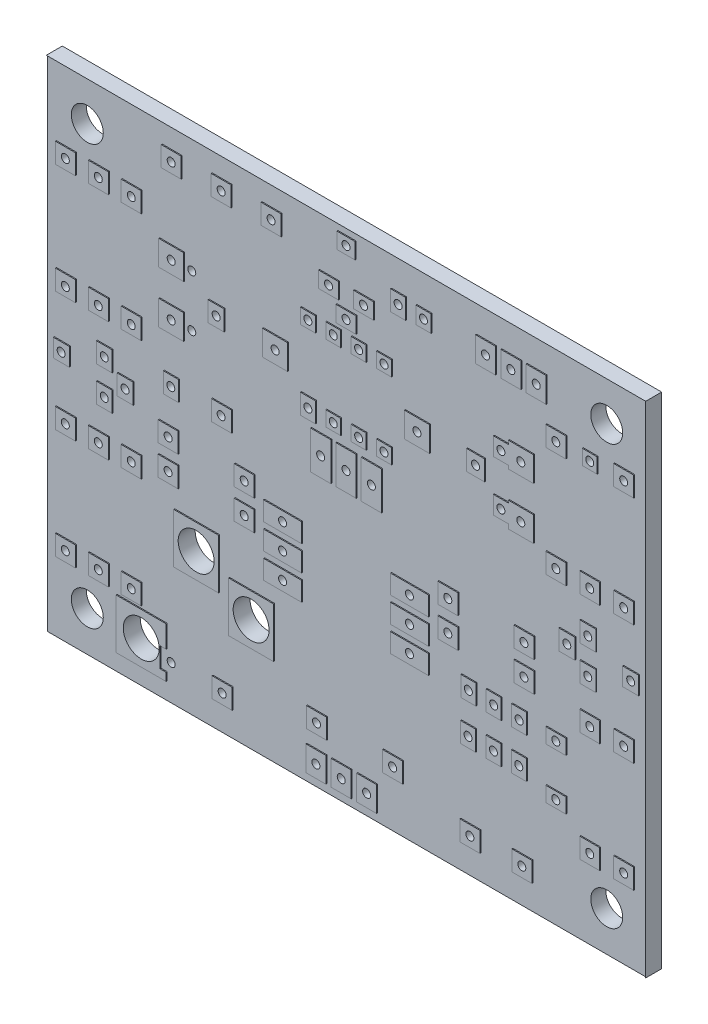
SolidWorks part; units mm, degrees
ref_plane "Plan de face" through (0, 0, 0) normal (0, 0, 1) x (1, 0, 0)
ref_plane "Plan de dessus" through (0, 0, 0) normal (0, 1, 0) x (1, 0, 0)
ref_plane "Plan de droite" through (0, 0, 0) normal (1, 0, 0) x (0, 0, -1)
sketch "Esquisse1" plane through (0, 0, 0) normal (0, 0, 1) x (1, 0, 0)
  line L1 (0, 0) -> (60, 0)
  line L2 (0, 0) -> (0, 50)
  line L3 (0, 50) -> (60, 50)
  line L4 (60, 0) -> (60, 50)
  dimension "D1" = 60
  dimension "D2" = 50
extrude "Extrusion1" add sketch "Esquisse1" along normal blind 1.7
sketch "Esquisse2" plane through (0, 0, 1.7) normal (0, 0, 1) x (1, 0, 0)
  line L408 (6.999, 1.702) -> (6.999, 6.702)
  line L409 (46.2499, 39.7499) -> (48.7499, 39.7499)
  line L410 (44.7569, 39.3829) -> (46.2569, 39.3829)
  line L411 (42.0669, 36.9429) -> (43.8669, 36.9429)
  line L412 (18.5, 45.9999) -> (16.5, 45.9999)
  line L413 (23.5, 45.9999) -> (21.5, 45.9999)
  line L414 (18.54, 26.4999) -> (16.54, 26.4999)
  line L415 (26.4439, 30.9049) -> (28.4759, 30.9049)
  line L416 (34.4449, 17.8875) -> (34.4449, 19.7925)
  line L417 (46.5451, 11.0587) -> (46.5451, 13.0587)
  line L418 (45.5051, 11.0587) -> (44.0051, 11.0587)
  line L419 (13.19, 24) -> (13.19, 22)
  line L420 (8.699, 24.001) -> (7.099, 24.001)
  line L421 (4.999, 24.251) -> (6.599, 24.251)
  line L422 (33.053, 39.3746) -> (33.053, 40.8746)
  line L423 (34.4661, 46.9861) -> (35.9661, 46.9861)
  line L424 (2.9, 18) -> (0.9, 18)
  line L425 (56.7999, 29.9999) -> (56.7999, 31.9999)
  line L426 (4.2, 9) -> (6.2, 9)
  line L427 (7.5, 42.9999) -> (9.5, 42.9999)
  line L428 (53.6499, 42.7499) -> (55.1499, 42.7499)
  line L429 (30.5219, 3.293) -> (30.5219, 0.793)
  line L430 (13.71, 32.4599) -> (13.71, 34.2599)
  line L431 (0, 49.9999) -> (59.9999, 49.9999)
  line L432 (13.75, 37.2499) -> (11.25, 37.2499)
  line L433 (13.75, 32.0499) -> (11.25, 32.0499)
  line L434 (43.8669, 36.9429) -> (43.8669, 34.9429)
  line L435 (13.4, 4.5) -> (13.4, 2.5)
  line L436 (11.5, 47.9999) -> (13.5, 47.9999)
  line L437 (51.9999, 15.29) -> (49.9999, 15.29)
  line L438 (33.5559, 30.9049) -> (33.5559, 27.0949)
  line L439 (38.2549, 17.8875) -> (34.4449, 17.8875)
  line L440 (41.4651, 11.0587) -> (41.4651, 13.0587)
  line L441 (41.4959, 17.068) -> (42.9959, 17.068)
  line L442 (42.9959, 15.068) -> (41.4959, 15.068)
  line L443 (45.5359, 15.068) -> (44.0359, 15.068)
  line L444 (33.6648, 6.6359) -> (35.6648, 6.6359)
  line L445 (41.1899, 22) -> (39.1899, 22)
  line L446 (27.2509, 45.0009) -> (29.2509, 45.0009)
  line L447 (29.2509, 43.4009) -> (27.2509, 43.4009)
  line L448 (32.7509, 43.4009) -> (30.7509, 43.4009)
  line L449 (30.7509, 43.4009) -> (30.7509, 45.0009)
  line L450 (34.5531, 33.2549) -> (34.5531, 31.7549)
  line L451 (38.5061, 46.8361) -> (38.5061, 45.1361)
  line L452 (38.5061, 45.1361) -> (37.0061, 45.1361)
  line L453 (2.9, 9) -> (2.9, 7)
  line L454 (6.2, 18) -> (4.2, 18)
  line L455 (51.9999, 31.9999) -> (51.9999, 29.9999)
  line L456 (58.7999, 20) -> (58.7999, 18)
  line L457 (9.5, 9) -> (9.5, 7)
  line L458 (9.5, 7) -> (7.5, 7)
  line L459 (9.5, 18) -> (7.5, 18)
  line L460 (48.0399, 47.2499) -> (50.0399, 47.2499)
  line L461 (48.0399, 44.7499) -> (48.0399, 47.2499)
  line L462 (12.7492, 12.0017) -> (12.7492, 17.0017)
  line L463 (22.749, 13.802) -> (22.749, 8.802)
  line L464 (11.999, 1.702) -> (6.999, 1.702)
  line L465 (48.7499, 34.5499) -> (48.7499, 32.0499)
  line L466 (48.7499, 37.2499) -> (46.2499, 37.2499)
  line L467 (13.5, 47.9999) -> (13.5, 45.9999)
  line L468 (28.9839, 27.0949) -> (28.9839, 30.9049)
  line L469 (42.9959, 17.068) -> (42.9959, 15.068)
  line L470 (20.81, 22) -> (18.81, 22)
  line L471 (59.3009, 25.8989) -> (59.3009, 24.099)
  line L472 (55.0009, 27.7489) -> (55.0009, 25.7489)
  line L473 (53.4009, 25.7489) -> (53.4009, 27.7489)
  line L474 (29.4731, 33.2549) -> (29.4731, 31.7549)
  line L475 (27.9731, 31.7549) -> (27.9731, 33.2549)
  line L476 (32.013, 33.2546) -> (32.013, 31.7546)
  line L477 (27.973, 40.8746) -> (29.473, 40.8746)
  line L478 (2.9, 31.9999) -> (2.9, 29.9999)
  line L479 (4.2, 31.9999) -> (6.2, 31.9999)
  line L480 (51.9999, 29.9999) -> (49.9999, 29.9999)
  line L481 (9.5, 29.9999) -> (7.5, 29.9999)
  line L482 (53.3999, 31.9999) -> (55.3999, 31.9999)
  line L483 (45.4999, 47.2499) -> (47.4999, 47.2499)
  line L484 (15.21, 39.3399) -> (15.21, 37.5399)
  line L485 (11.25, 34.5499) -> (13.75, 34.5499)
  line L486 (21.65, 34.6499) -> (21.65, 37.1499)
  line L487 (48.7499, 32.0499) -> (46.2499, 32.0499)
  line L488 (46.2499, 37.2499) -> (46.2499, 39.7499)
  line L489 (42.0669, 34.9429) -> (42.0669, 36.9429)
  line L490 (41.3999, 2.5) -> (41.3999, 4.5)
  line L491 (34.4449, 22.3325) -> (38.2549, 22.3325)
  line L492 (34.4449, 19.7925) -> (38.2549, 19.7925)
  line L493 (45.5051, 13.0587) -> (45.5051, 11.0587)
  line L494 (44.0359, 17.068) -> (45.5359, 17.068)
  line L495 (46.8099, 24) -> (48.8099, 24)
  line L496 (46.8099, 22) -> (46.8099, 24)
  line L497 (46.8099, 21) -> (48.8099, 21)
  line L498 (29.0009, 41.3009) -> (29.0009, 42.9009)
  line L499 (0.699, 24.101) -> (0.699, 25.9009)
  line L500 (33.0531, 33.2549) -> (34.5531, 33.2549)
  line L501 (35.9661, 46.9861) -> (35.9661, 44.9861)
  line L502 (7.5, 29.9999) -> (7.5, 31.9999)
  line L503 (53.3999, 18) -> (53.3999, 20)
  line L504 (31.0619, 3.293) -> (33.0619, 3.293)
  line L505 (16.2, 36.8999) -> (17.8, 36.8999)
  line L506 (17.2492, 12.0017) -> (12.7492, 12.0017)
  line L507 (35.8499, 37.1499) -> (38.3499, 37.1499)
  line L508 (16.6, 2.5) -> (16.6, 4.5)
  line L509 (13.4, 2.5) -> (11.4, 2.5)
  line L510 (49.9999, 11.71) -> (51.9999, 11.71)
  line L511 (49.9999, 10.21) -> (49.9999, 11.71)
  line L512 (38.2549, 22.3325) -> (38.2549, 20.4275)
  line L513 (34.4449, 15.3475) -> (34.4449, 17.2525)
  line L514 (25.5549, 17.8875) -> (21.745, 17.8875)
  line L515 (41.4651, 13.0587) -> (42.9651, 13.0587)
  line L516 (26.0448, 6.6359) -> (28.0448, 6.6359)
  line L517 (11.19, 22) -> (11.19, 24)
  line L518 (20.81, 21) -> (20.81, 19)
  line L519 (18.81, 19) -> (18.81, 21)
  line L520 (39.1899, 21) -> (41.1899, 21)
  line L521 (41.1899, 21) -> (41.1899, 19)
  line L522 (30.7509, 45.0009) -> (32.7509, 45.0009)
  line L523 (4.999, 22.251) -> (4.999, 24.251)
  line L524 (26.9331, 31.5049) -> (25.4331, 31.5049)
  line L525 (30.5131, 40.8749) -> (32.0131, 40.8749)
  line L526 (37.0061, 45.1361) -> (37.0061, 46.8361)
  line L527 (0.9, 31.9999) -> (2.9, 31.9999)
  line L528 (0.9, 40.9999) -> (0.9, 42.9999)
  line L529 (58.7999, 31.9999) -> (58.7999, 29.9999)
  line L530 (4.2, 20) -> (6.2, 20)
  line L531 (9.5, 40.9999) -> (7.5, 40.9999)
  line L532 (42.9599, 47.2499) -> (44.9599, 47.2499)
  line L533 (44.9599, 44.7499) -> (42.9599, 44.7499)
  line L534 (33.0619, 3.293) -> (33.0619, 0.793)
  line L535 (30.5219, 0.793) -> (28.5219, 0.793)
  line L536 (13.75, 34.5499) -> (13.75, 32.0499)
  line L537 (44.7569, 32.5029) -> (44.7569, 34.3029)
  line L538 (48.5999, 4.5) -> (48.5999, 2.5)
  line L539 (16.6, 4.5) -> (18.6, 4.5)
  line L540 (18.6, 4.5) -> (18.6, 2.5)
  line L541 (16.54, 28.4999) -> (18.54, 28.4999)
  line L542 (21.745, 22.3325) -> (25.5549, 22.3325)
  line L543 (21.745, 19.7925) -> (25.5549, 19.7925)
  line L544 (21.745, 17.2525) -> (25.5549, 17.2525)
  line L545 (25.5549, 17.2525) -> (25.5549, 15.3475)
  line L546 (41.1899, 19) -> (39.1899, 19)
  line L547 (7.099, 26.0009) -> (8.699, 26.0009)
  line L548 (59.3009, 24.099) -> (57.7009, 24.099)
  line L549 (29.473, 40.8746) -> (29.473, 39.3746)
  line L550 (25.433, 40.8746) -> (26.933, 40.8746)
  line L551 (37.0061, 46.8361) -> (38.5061, 46.8361)
  line L552 (0.9, 18) -> (0.9, 20)
  line L553 (4.2, 42.9999) -> (6.2, 42.9999)
  line L554 (6.2, 42.9999) -> (6.2, 40.9999)
  line L555 (6.2, 7) -> (4.2, 7)
  line L556 (56.7999, 18) -> (56.7999, 20)
  line L557 (9.5, 20) -> (9.5, 18)
  line L558 (55.1499, 41.2499) -> (53.6499, 41.2499)
  line L559 (47.4999, 47.2499) -> (47.4999, 44.7499)
  line L560 (27.9819, 3.293) -> (27.9819, 0.793)
  line L561 (15.21, 37.5399) -> (13.71, 37.5399)
  line L562 (12.7492, 17.0017) -> (17.2492, 17.0017)
  line L563 (22.749, 8.802) -> (18.249, 8.802)
  line L564 (13.75, 39.7499) -> (13.75, 37.2499)
  line L565 (11.71, 26.4999) -> (11.71, 28.4999)
  line L566 (31.5239, 30.9049) -> (33.5559, 30.9049)
  line L567 (44.0051, 13.0587) -> (45.5051, 13.0587)
  line L568 (11.19, 19) -> (11.19, 21)
  line L569 (6.599, 24.251) -> (6.599, 22.251)
  line L570 (52.9009, 23.999) -> (51.3009, 23.999)
  line L571 (25.4331, 33.5049) -> (26.9331, 33.5049)
  line L572 (25.4331, 31.5049) -> (25.4331, 33.5049)
  line L573 (33.053, 40.8746) -> (34.553, 40.8746)
  line L574 (0.9, 20) -> (2.9, 20)
  line L575 (4.2, 18) -> (4.2, 20)
  line L576 (58.7999, 18) -> (56.7999, 18)
  line L577 (9.5, 31.9999) -> (9.5, 29.9999)
  line L578 (7.5, 18) -> (7.5, 20)
  line L579 (55.3999, 7) -> (53.3999, 7)
  line L580 (53.3999, 7) -> (53.3999, 9)
  line L581 (13.71, 39.3399) -> (15.21, 39.3399)
  line L582 (21.65, 37.1499) -> (24.15, 37.1499)
  line L583 (46.2499, 32.0499) -> (46.2499, 34.5499)
  line L584 (38.3499, 37.1499) -> (38.3499, 34.6499)
  line L585 (44.7569, 37.5829) -> (44.7569, 39.3829)
  line L586 (43.3999, 2.5) -> (41.3999, 2.5)
  line L587 (49.9999, 16.79) -> (51.9999, 16.79)
  line L588 (13.21, 28.4999) -> (13.21, 26.4999)
  line L589 (28.4759, 30.9049) -> (28.4759, 27.0949)
  line L590 (31.0159, 30.9049) -> (31.0159, 27.0949)
  line L591 (48.0451, 13.0587) -> (48.0451, 11.0587)
  line L592 (46.5759, 17.068) -> (48.0759, 17.068)
  line L593 (48.8099, 22) -> (46.8099, 22)
  line L594 (11.19, 21) -> (13.19, 21)
  line L595 (48.8099, 21) -> (48.8099, 19)
  line L596 (31.0009, 41.3009) -> (29.0009, 41.3009)
  line L597 (29.2509, 45.0009) -> (29.2509, 43.4009)
  line L598 (27.9731, 33.2549) -> (29.4731, 33.2549)
  line L599 (29.4731, 31.7549) -> (27.9731, 31.7549)
  line L600 (34.553, 39.3746) -> (33.053, 39.3746)
  line L601 (25.433, 39.3746) -> (25.433, 40.8746)
  line L602 (4.2, 7) -> (4.2, 9)
  line L603 (49.9999, 42.9999) -> (51.9999, 42.9999)
  line L604 (7.5, 31.9999) -> (9.5, 31.9999)
  line L605 (53.3999, 9) -> (55.3999, 9)
  line L606 (50.0399, 44.7499) -> (48.0399, 44.7499)
  line L607 (25.9819, 3.293) -> (27.9819, 3.293)
  line L608 (17.8, 34.8999) -> (16.2, 34.8999)
  line L609 (11.25, 37.2499) -> (11.25, 39.7499)
  line L610 (46.5999, 4.5) -> (48.5999, 4.5)
  line L611 (11.4, 2.5) -> (11.4, 4.5)
  line L612 (51.9999, 16.79) -> (51.9999, 15.29)
  line L613 (16.54, 26.4999) -> (16.54, 28.4999)
  line L614 (28.9839, 30.9049) -> (31.0159, 30.9049)
  line L615 (31.5239, 27.0949) -> (31.5239, 30.9049)
  line L616 (34.4449, 20.4275) -> (34.4449, 22.3325)
  line L617 (25.5549, 22.3325) -> (25.5549, 20.4275)
  line L618 (35.6648, 6.6359) -> (35.6648, 4.6359)
  line L619 (48.8099, 24) -> (48.8099, 22)
  line L620 (18.81, 24) -> (20.81, 24)
  line L621 (18.81, 22) -> (18.81, 24)
  line L622 (48.8099, 19) -> (46.8099, 19)
  line L623 (57.7009, 24.099) -> (57.7009, 25.8989)
  line L624 (26.933, 40.8746) -> (26.933, 39.3746)
  line L625 (56.7999, 31.9999) -> (58.7999, 31.9999)
  line L626 (6.2, 40.9999) -> (4.2, 40.9999)
  line L627 (51.9999, 42.9999) -> (51.9999, 40.9999)
  line L628 (42.9599, 44.7499) -> (42.9599, 47.2499)
  line L629 (59.9999, 0) -> (0, 0)
  line L630 (24.15, 34.6499) -> (21.65, 34.6499)
  line L631 (48.7499, 39.7499) -> (48.7499, 37.2499)
  line L632 (51.9999, 11.71) -> (51.9999, 10.21)
  line L633 (31.0159, 27.0949) -> (28.9839, 27.0949)
  line L634 (21.745, 15.3475) -> (21.745, 17.2525)
  line L635 (46.5451, 13.0587) -> (48.0451, 13.0587)
  line L636 (48.0451, 11.0587) -> (46.5451, 11.0587)
  line L637 (48.0759, 17.068) -> (48.0759, 15.068)
  line L638 (28.0448, 4.6359) -> (26.0448, 4.6359)
  line L639 (39.1899, 22) -> (39.1899, 24)
  line L640 (30.9009, 47.7009) -> (29.1009, 47.7009)
  line L641 (29.0009, 42.9009) -> (31.0009, 42.9009)
  line L642 (51.3009, 23.999) -> (51.3009, 25.9989)
  line L643 (29.473, 39.3746) -> (27.973, 39.3746)
  line L644 (0.9, 7) -> (0.9, 9)
  line L645 (4.2, 40.9999) -> (4.2, 42.9999)
  line L646 (49.9999, 29.9999) -> (49.9999, 31.9999)
  line L647 (55.1499, 42.7499) -> (55.1499, 41.2499)
  line L648 (55.3999, 20) -> (55.3999, 18)
  line L649 (44.9599, 47.2499) -> (44.9599, 44.7499)
  line L650 (17.2492, 17.0017) -> (17.2492, 12.0017)
  line L651 (24.15, 37.1499) -> (24.15, 34.6499)
  line L652 (35.8499, 34.6499) -> (35.8499, 37.1499)
  line L653 (43.8669, 34.9429) -> (42.0669, 34.9429)
  line L654 (46.5999, 2.5) -> (46.5999, 4.5)
  line L655 (41.3999, 4.5) -> (43.3999, 4.5)
  line L656 (18.6, 2.5) -> (16.6, 2.5)
  line L657 (11.4, 4.5) -> (13.4, 4.5)
  line L658 (51.9999, 10.21) -> (49.9999, 10.21)
  line L659 (18.54, 28.4999) -> (18.54, 26.4999)
  line L660 (11.71, 28.4999) -> (13.21, 28.4999)
  line L661 (28.4759, 27.0949) -> (26.4439, 27.0949)
  line L662 (33.5559, 27.0949) -> (31.5239, 27.0949)
  line L663 (35.6648, 4.6359) -> (33.6648, 4.6359)
  line L664 (39.1899, 19) -> (39.1899, 21)
  line L665 (46.8099, 19) -> (46.8099, 21)
  line L666 (30.9009, 49.3009) -> (30.9009, 47.7009)
  line L667 (29.1009, 47.7009) -> (29.1009, 49.3009)
  line L668 (27.2509, 43.4009) -> (27.2509, 45.0009)
  line L669 (6.599, 25.7509) -> (4.999, 25.7509)
  line L670 (55.0009, 25.7489) -> (53.4009, 25.7489)
  line L671 (55.0009, 24.249) -> (55.0009, 22.249)
  line L672 (53.4009, 22.249) -> (53.4009, 24.249)
  line L673 (32.013, 31.7546) -> (30.513, 31.7546)
  line L674 (35.9661, 44.9861) -> (34.4661, 44.9861)
  line L675 (2.9, 7) -> (0.9, 7)
  line L676 (58.7999, 40.9999) -> (56.7999, 40.9999)
  line L677 (56.7999, 40.9999) -> (56.7999, 42.9999)
  line L678 (6.2, 29.9999) -> (4.2, 29.9999)
  line L679 (6.2, 9) -> (6.2, 7)
  line L680 (7.5, 20) -> (9.5, 20)
  line L681 (45.4999, 44.7499) -> (45.4999, 47.2499)
  line L682 (28.5219, 3.293) -> (30.5219, 3.293)
  line L683 (25.9819, 0.793) -> (25.9819, 3.293)
  line L684 (17.8, 36.8999) -> (17.8, 34.8999)
  line L685 (13.71, 37.5399) -> (13.71, 39.3399)
  line L686 (13.71, 34.2599) -> (15.21, 34.2599)
  line L687 (11.25, 39.7499) -> (13.75, 39.7499)
  line L688 (44.7569, 34.3029) -> (46.2569, 34.3029)
  line L689 (48.5999, 2.5) -> (46.5999, 2.5)
  line L690 (13.5, 45.9999) -> (11.5, 45.9999)
  line L691 (13.21, 26.4999) -> (11.71, 26.4999)
  line L692 (34.4449, 17.2525) -> (38.2549, 17.2525)
  line L693 (21.745, 20.4275) -> (21.745, 22.3325)
  line L694 (42.9651, 11.0587) -> (41.4651, 11.0587)
  line L695 (45.5359, 17.068) -> (45.5359, 15.068)
  line L696 (28.0448, 6.6359) -> (28.0448, 4.6359)
  line L697 (13.19, 21) -> (13.19, 19)
  line L698 (6.599, 27.7509) -> (6.599, 25.7509)
  line L699 (57.7009, 25.8989) -> (59.3009, 25.8989)
  line L700 (26.9331, 33.5049) -> (26.9331, 31.5049)
  line L701 (30.513, 31.7546) -> (30.513, 33.2546)
  line L702 (2.9, 42.9999) -> (2.9, 40.9999)
  line L703 (58.7999, 42.9999) -> (58.7999, 40.9999)
  line L704 (6.2, 31.9999) -> (6.2, 29.9999)
  line L705 (49.9999, 40.9999) -> (49.9999, 42.9999)
  line L706 (56.7999, 9) -> (58.7999, 9)
  line L707 (9.5, 42.9999) -> (9.5, 40.9999)
  line L708 (53.3999, 29.9999) -> (53.3999, 31.9999)
  line L709 (53.3999, 20) -> (55.3999, 20)
  line L710 (0, 0) -> (0, 49.9999)
  line L711 (59.9999, 49.9999) -> (59.9999, 0)
  line L712 (46.2569, 37.5829) -> (44.7569, 37.5829)
  line L713 (46.2569, 32.5029) -> (44.7569, 32.5029)
  line L714 (18.5, 47.9999) -> (18.5, 45.9999)
  line L715 (21.5, 47.9999) -> (23.5, 47.9999)
  line L716 (21.745, 17.8875) -> (21.745, 19.7925)
  line L717 (25.5549, 15.3475) -> (21.745, 15.3475)
  line L718 (44.0359, 15.068) -> (44.0359, 17.068)
  line L719 (41.1899, 24) -> (41.1899, 22)
  line L720 (13.19, 22) -> (11.19, 22)
  line L721 (0.699, 25.9009) -> (2.299, 25.9009)
  line L722 (2.299, 25.9009) -> (2.299, 24.101)
  line L723 (7.099, 24.001) -> (7.099, 26.0009)
  line L724 (4.999, 25.7509) -> (4.999, 27.7509)
  line L725 (55.0009, 22.249) -> (53.4009, 22.249)
  line L726 (33.0531, 31.7549) -> (33.0531, 33.2549)
  line L727 (49.9999, 31.9999) -> (51.9999, 31.9999)
  line L728 (7.5, 7) -> (7.5, 9)
  line L729 (6.999, 6.702) -> (11.999, 6.702)
  line L730 (46.2499, 34.5499) -> (48.7499, 34.5499)
  line L731 (38.2549, 19.7925) -> (38.2549, 17.8875)
  line L732 (25.5549, 20.4275) -> (21.745, 20.4275)
  line L733 (25.5549, 19.7925) -> (25.5549, 17.8875)
  line L734 (48.0759, 15.068) -> (46.5759, 15.068)
  line L735 (32.7509, 45.0009) -> (32.7509, 43.4009)
  line L736 (6.599, 22.251) -> (4.999, 22.251)
  line L737 (51.3009, 25.9989) -> (52.9009, 25.9989)
  line L738 (53.4009, 24.249) -> (55.0009, 24.249)
  line L739 (32.0131, 39.3749) -> (30.5131, 39.3749)
  line L740 (2.9, 29.9999) -> (0.9, 29.9999)
  line L741 (4.2, 29.9999) -> (4.2, 31.9999)
  line L742 (51.9999, 40.9999) -> (49.9999, 40.9999)
  line L743 (56.7999, 7) -> (56.7999, 9)
  line L744 (7.5, 9) -> (9.5, 9)
  line L745 (47.4999, 44.7499) -> (45.4999, 44.7499)
  line L746 (28.5219, 0.793) -> (28.5219, 3.293)
  line L747 (15.21, 34.2599) -> (15.21, 32.4599)
  line L748 (18.249, 8.802) -> (18.249, 13.802)
  line L749 (11.999, 6.702) -> (11.999, 1.702)
  line L750 (46.2569, 39.3829) -> (46.2569, 37.5829)
  line L751 (23.5, 47.9999) -> (23.5, 45.9999)
  line L752 (21.5, 45.9999) -> (21.5, 47.9999)
  line L753 (26.4439, 27.0949) -> (26.4439, 30.9049)
  line L754 (42.9651, 13.0587) -> (42.9651, 11.0587)
  line L755 (33.6648, 4.6359) -> (33.6648, 6.6359)
  line L756 (53.4009, 27.7489) -> (55.0009, 27.7489)
  line L757 (30.513, 33.2546) -> (32.013, 33.2546)
  line L758 (34.553, 40.8746) -> (34.553, 39.3746)
  line L759 (2.9, 20) -> (2.9, 18)
  line L760 (58.7999, 29.9999) -> (56.7999, 29.9999)
  line L761 (56.7999, 42.9999) -> (58.7999, 42.9999)
  line L762 (6.2, 20) -> (6.2, 18)
  line L763 (58.7999, 7) -> (56.7999, 7)
  line L764 (7.5, 40.9999) -> (7.5, 42.9999)
  line L765 (55.3999, 29.9999) -> (53.3999, 29.9999)
  line L766 (55.3999, 9) -> (55.3999, 7)
  line L767 (15.21, 32.4599) -> (13.71, 32.4599)
  line L768 (18.249, 13.802) -> (22.749, 13.802)
  line L769 (38.3499, 34.6499) -> (35.8499, 34.6499)
  line L770 (46.2569, 34.3029) -> (46.2569, 32.5029)
  line L771 (16.5, 47.9999) -> (18.5, 47.9999)
  line L772 (16.5, 45.9999) -> (16.5, 47.9999)
  line L773 (38.2549, 20.4275) -> (34.4449, 20.4275)
  line L774 (46.5759, 15.068) -> (46.5759, 17.068)
  line L775 (39.1899, 24) -> (41.1899, 24)
  line L776 (13.19, 19) -> (11.19, 19)
  line L777 (31.0009, 42.9009) -> (31.0009, 41.3009)
  line L778 (2.299, 24.101) -> (0.699, 24.101)
  line L779 (52.9009, 25.9989) -> (52.9009, 23.999)
  line L780 (34.5531, 31.7549) -> (33.0531, 31.7549)
  line L781 (27.973, 39.3746) -> (27.973, 40.8746)
  line L782 (34.4661, 44.9861) -> (34.4661, 46.9861)
  line L783 (0.9, 9) -> (2.9, 9)
  line L784 (56.7999, 20) -> (58.7999, 20)
  line L785 (55.3999, 31.9999) -> (55.3999, 29.9999)
  line L786 (53.6499, 41.2499) -> (53.6499, 42.7499)
  line L787 (16.2, 34.8999) -> (16.2, 36.8999)
  line L788 (11.25, 32.0499) -> (11.25, 34.5499)
  line L789 (43.3999, 4.5) -> (43.3999, 2.5)
  line L790 (11.5, 45.9999) -> (11.5, 47.9999)
  line L791 (49.9999, 15.29) -> (49.9999, 16.79)
  line L792 (38.2549, 17.2525) -> (38.2549, 15.3475)
  line L793 (38.2549, 15.3475) -> (34.4449, 15.3475)
  line L794 (44.0051, 11.0587) -> (44.0051, 13.0587)
  line L795 (41.4959, 15.068) -> (41.4959, 17.068)
  line L796 (26.0448, 4.6359) -> (26.0448, 6.6359)
  line L797 (20.81, 24) -> (20.81, 22)
  line L798 (11.19, 24) -> (13.19, 24)
  line L799 (18.81, 21) -> (20.81, 21)
  line L800 (20.81, 19) -> (18.81, 19)
  line L801 (29.1009, 49.3009) -> (30.9009, 49.3009)
  line L802 (8.699, 26.0009) -> (8.699, 24.001)
  line L803 (4.999, 27.7509) -> (6.599, 27.7509)
  line L804 (32.0131, 40.8749) -> (32.0131, 39.3749)
  line L805 (30.5131, 39.3749) -> (30.5131, 40.8749)
  line L806 (26.933, 39.3746) -> (25.433, 39.3746)
  line L807 (0.9, 29.9999) -> (0.9, 31.9999)
  line L808 (0.9, 42.9999) -> (2.9, 42.9999)
  line L809 (2.9, 40.9999) -> (0.9, 40.9999)
  line L810 (58.7999, 9) -> (58.7999, 7)
  line L811 (55.3999, 18) -> (53.3999, 18)
  line L812 (50.0399, 47.2499) -> (50.0399, 44.7499)
  line L813 (33.0619, 0.793) -> (31.0619, 0.793)
  line L814 (31.0619, 0.793) -> (31.0619, 3.293)
  line L815 (27.9819, 0.793) -> (25.9819, 0.793)
  point P1 (35.2161, 45.9999)
  point P2 (37.7561, 45.9999)
  point P3 (43.9599, 45.9999)
  point P4 (46.4999, 45.9999)
  point P5 (49.0399, 45.9999)
  point P6 (50.9999, 41.9999)
  point P7 (54.3999, 41.9999)
  point P8 (57.7999, 41.9999)
  point P9 (12.5, 46.9861)
  point P10 (17.5, 46.9861)
  point P11 (22.5, 46.9861)
  point P12 (30.0009, 48.5009)
  point P13 (28.2509, 44.2009)
  point P14 (31.7509, 44.2009)
  point P15 (47.4999, 38.4999)
  point P16 (45.5069, 38.4829)
  point P17 (42.9669, 35.9429)
  point P18 (47.4999, 33.2999)
  point P19 (45.5069, 33.4029)
  point P20 (50.9999, 30.9999)
  point P21 (54.3999, 30.9999)
  point P22 (57.7999, 30.9999)
  point P23 (54.2009, 26.7489)
  point P24 (58.5009, 24.999)
  point P25 (54.2009, 23.249)
  point P26 (54.3999, 19)
  point P27 (57.7999, 19)
  point P28 (50.9999, 16.04)
  point P29 (47.3259, 16.04)
  point P30 (44.7859, 16.068)
  point P31 (42.2459, 16.068)
  point P32 (42.2151, 12.0587)
  point P33 (44.7551, 12.0587)
  point P34 (47.2951, 12.0587)
  point P35 (50.9999, 10.96)
  point P36 (54.3999, 8)
  point P37 (57.7999, 8)
  point P38 (47.5999, 3.5)
  point P39 (42.3999, 3.5)
  point P40 (34.6648, 5.6359)
  point P41 (32.0619, 2.043)
  point P42 (29.5219, 2.043)
  point P43 (26.9819, 2.043)
  point P44 (27.0448, 5.6359)
  point P45 (20.499, 11.302)
  point P46 (17.6, 3.5)
  point P47 (12.4, 3.5)
  point P48 (9.499, 4.202)
  point P49 (8.5, 8)
  point P50 (5.2, 8)
  point P51 (1.9, 8)
  point P52 (1.9, 19)
  point P53 (5.2, 19)
  point P54 (8.5, 19)
  point P55 (12.19, 20)
  point P56 (30.0009, 42.1009)
  point P57 (26.183, 40.1246)
  point P58 (28.723, 40.1246)
  point P59 (31.2631, 40.1246)
  point P60 (33.803, 40.1246)
  point P61 (37.0999, 35.8999)
  point P62 (33.8031, 32.5029)
  point P63 (31.263, 32.5029)
  point P64 (28.7231, 32.5029)
  point P65 (26.1831, 32.5029)
  point P66 (22.9, 35.8999)
  point P67 (17, 35.8999)
  point P68 (14.46, 38.4829)
  point P69 (12.5, 38.4829)
  point P70 (8.5, 41.9999)
  point P71 (5.2, 41.9999)
  point P72 (1.9, 41.9999)
  point P73 (1.9, 30.9049)
  point P74 (5.2, 30.9049)
  point P75 (8.5, 30.9049)
  point P76 (5.799, 26.7489)
  point P77 (12.46, 27.4999)
  point P78 (17.5, 27.4999)
  point P79 (12.5, 33.2999)
  point P80 (14.46, 33.2999)
  point P81 (1.482, 24.999)
  point P82 (7.8779, 24.999)
  point P83 (5.799, 23.249)
  point P84 (12.19, 23)
  point P85 (19.81, 23)
  point P86 (19.81, 20)
  point P87 (23.65, 21.38)
  point P88 (23.65, 18.84)
  point P89 (23.65, 16.3)
  point P90 (14.9992, 14.5017)
  point P91 (36.3499, 16.3)
  point P92 (36.3499, 18.84)
  point P93 (36.3499, 21.38)
  point P94 (40.1899, 23)
  point P95 (40.1899, 20)
  point P96 (47.8099, 20)
  point P97 (47.8099, 23)
  point P98 (52.1009, 24.999)
  point P99 (27.4599, 28.9999)
  point P100 (29.9999, 28.9999)
  point P101 (32.5399, 28.9999)
extrude "Extrusion4" cut sketch "Esquisse2" against normal blind 0.1
sketch "Esquisse5" plane through (0, 0, 1.7) normal (0, 0, 1) x (1, 0, 0)
  circle A0 centre (12.5, 46.9861) radius 0.4
  circle A1 centre (17.5, 46.9861) radius 0.4
  circle A2 centre (22.5, 46.9861) radius 0.4
  circle A3 centre (30.0009, 48.5009) radius 0.4
  circle A4 centre (28.2509, 44.2009) radius 0.4
  circle A5 centre (31.7509, 44.2009) radius 0.4
  circle A6 centre (35.2161, 45.9999) radius 0.4
  circle A7 centre (37.7561, 45.9999) radius 0.4
  circle A8 centre (42.9669, 35.9429) radius 0.4
  circle A9 centre (45.5069, 38.4829) radius 0.4
  circle A10 centre (43.9599, 45.9999) radius 0.4
  circle A11 centre (46.4999, 45.9999) radius 0.4
  circle A12 centre (49.0399, 45.9999) radius 0.4
  circle A13 centre (50.9999, 41.9999) radius 0.4
  circle A14 centre (1.9, 41.9999) radius 0.4
  circle A15 centre (5.2, 41.9999) radius 0.4
  circle A16 centre (8.5, 41.9999) radius 0.4
  circle A17 centre (12.5, 38.4829) radius 0.4
  circle A18 centre (14.46, 38.4829) radius 0.4
  circle A19 centre (17, 35.8999) radius 0.4
  circle A20 centre (12.5, 33.2999) radius 0.4
  circle A21 centre (14.46, 33.2999) radius 0.4
  circle A22 centre (22.9, 35.8999) radius 0.4
  circle A23 centre (26.183, 40.1246) radius 0.4
  circle A24 centre (30.0009, 42.1009) radius 0.4
  circle A25 centre (28.723, 40.1246) radius 0.4
  circle A26 centre (31.2631, 40.1246) radius 0.4
  circle A27 centre (33.803, 40.1246) radius 0.4
  circle A28 centre (8.5, 30.9049) radius 0.4
  circle A29 centre (5.2, 30.9049) radius 0.4
  circle A30 centre (1.9, 30.9049) radius 0.4
  circle A31 centre (1.482, 24.999) radius 0.4
  circle A32 centre (5.799, 26.7489) radius 0.4
  circle A33 centre (7.8779, 24.999) radius 0.4
  circle A34 centre (5.799, 23.249) radius 0.4
  circle A35 centre (12.46, 27.4999) radius 0.4
  circle A36 centre (17.5, 27.4999) radius 0.4
  circle A37 centre (26.1831, 32.5029) radius 0.4
  circle A38 centre (28.7231, 32.5029) radius 0.4
  circle A39 centre (31.263, 32.5029) radius 0.4
  circle A40 centre (33.8031, 32.5029) radius 0.4
  circle A41 centre (37.0999, 35.8999) radius 0.4
  circle A42 centre (27.4599, 28.9999) radius 0.4
  circle A43 centre (29.9999, 28.9999) radius 0.4
  circle A44 centre (32.5399, 28.9999) radius 0.4
  circle A45 centre (45.5069, 33.4029) radius 0.4
  circle A46 centre (47.4999, 38.4999) radius 0.4
  circle A47 centre (54.3999, 41.9999) radius 0.4
  circle A48 centre (57.7999, 41.9999) radius 0.4
  circle A49 centre (47.4999, 33.2999) radius 0.4
  circle A50 centre (50.9999, 30.9999) radius 0.4
  circle A51 centre (54.3999, 30.9999) radius 0.4
  circle A52 centre (57.7999, 30.9999) radius 0.4
  circle A53 centre (54.2009, 26.7489) radius 0.4
  circle A54 centre (58.5009, 24.999) radius 0.4
  circle A55 centre (52.1009, 24.999) radius 0.4
  circle A56 centre (54.2009, 23.249) radius 0.4
  circle A57 centre (47.8099, 23) radius 0.4
  circle A58 centre (47.8099, 20) radius 0.4
  circle A59 centre (54.3999, 19) radius 0.4
  circle A60 centre (57.7999, 19) radius 0.4
  circle A61 centre (50.9999, 16.04) radius 0.4
  circle A62 centre (47.3259, 16.04) radius 0.4
  circle A63 centre (44.7859, 16.068) radius 0.4
  circle A64 centre (42.2459, 16.068) radius 0.4
  circle A65 centre (40.1899, 23) radius 0.4
  circle A66 centre (40.1899, 20) radius 0.4
  circle A67 centre (36.3499, 21.38) radius 0.4
  circle A68 centre (36.3499, 18.84) radius 0.4
  circle A69 centre (36.3499, 16.3) radius 0.4
  circle A70 centre (23.65, 21.38) radius 0.4
  circle A71 centre (23.65, 18.84) radius 0.4
  circle A72 centre (19.81, 23) radius 0.4
  circle A73 centre (19.81, 20) radius 0.4
  circle A74 centre (12.19, 23) radius 0.4
  circle A75 centre (14.9992, 14.5017) radius 0.4
  circle A76 centre (23.65, 16.3) radius 0.4
  circle A77 centre (12.19, 20) radius 0.4
  circle A78 centre (1.9, 19) radius 0.4
  circle A79 centre (5.2, 19) radius 0.4
  circle A80 centre (8.5, 19) radius 0.4
  circle A81 centre (20.499, 11.302) radius 0.4
  circle A82 centre (1.9, 8) radius 0.4
  circle A83 centre (5.2, 8) radius 0.4
  circle A84 centre (8.5, 8) radius 0.4
  circle A85 centre (9.499, 4.202) radius 0.4
  circle A86 centre (12.4, 3.5) radius 0.4
  circle A87 centre (17.6, 3.5) radius 0.4
  circle A88 centre (27.0448, 5.6359) radius 0.4
  circle A89 centre (26.9819, 2.043) radius 0.4
  circle A90 centre (29.5219, 2.043) radius 0.4
  circle A91 centre (32.0619, 2.043) radius 0.4
  circle A92 centre (34.6648, 5.6359) radius 0.4
  circle A93 centre (42.2151, 12.0587) radius 0.4
  circle A94 centre (44.7551, 12.0587) radius 0.4
  circle A95 centre (47.2951, 12.0587) radius 0.4
  circle A96 centre (50.9999, 10.96) radius 0.4
  circle A97 centre (42.3999, 3.5) radius 0.4
  circle A98 centre (47.5999, 3.5) radius 0.4
  circle A99 centre (54.3999, 8) radius 0.4
  circle A100 centre (57.7999, 8) radius 0.4
  dimension "D1" = 0.8
  dimension "D2" = 0.8
extrude "Extrusion2" cut sketch "Esquisse5" against normal blind 1.7
sketch "Esquisse7" plane through (0, 0, 0) normal (0, 0, -1) x (-1, 0, 0)
  line L0 (0, 50) -> (-60, 50)
  line L1 (0, 0) -> (-60, 0)
  line L2 (0, 50) -> (0, 0)
  line L409 (-60, 50) -> (-60, 0)
  line L410 (-13.71, 32.46) -> (-13.71, 34.26)
  line L411 (-15.21, 32.46) -> (-13.71, 32.46)
  line L412 (-15.21, 34.26) -> (-15.21, 32.46)
  line L413 (-13.71, 34.26) -> (-15.21, 34.26)
  line L414 (-13.71, 37.54) -> (-13.71, 39.34)
  line L415 (-15.21, 37.54) -> (-13.71, 37.54)
  line L416 (-15.21, 39.34) -> (-15.21, 37.54)
  line L417 (-13.71, 39.34) -> (-15.21, 39.34)
  line L418 (-16.2, 34.9) -> (-16.2, 36.9)
  line L419 (-17.8, 34.9) -> (-16.2, 34.9)
  line L420 (-17.8, 36.9) -> (-17.8, 34.9)
  line L421 (-16.2, 36.9) -> (-17.8, 36.9)
  line L422 (-25.982, 0.793) -> (-25.982, 3.293)
  line L423 (-27.982, 0.793) -> (-25.982, 0.793)
  line L424 (-27.982, 3.293) -> (-27.982, 0.793)
  line L425 (-25.982, 3.293) -> (-27.982, 3.293)
  line L426 (-28.522, 0.793) -> (-28.522, 3.293)
  line L427 (-30.522, 0.793) -> (-28.522, 0.793)
  line L428 (-30.522, 3.293) -> (-30.522, 0.793)
  line L429 (-28.522, 3.293) -> (-30.522, 3.293)
  line L430 (-31.062, 0.793) -> (-31.062, 3.293)
  line L431 (-33.062, 0.793) -> (-31.062, 0.793)
  line L432 (-33.062, 3.293) -> (-33.062, 0.793)
  line L433 (-31.062, 3.293) -> (-33.062, 3.293)
  line L434 (-42.96, 44.75) -> (-42.96, 47.25)
  line L435 (-44.96, 44.75) -> (-42.96, 44.75)
  line L436 (-44.96, 47.25) -> (-44.96, 44.75)
  line L437 (-42.96, 47.25) -> (-44.96, 47.25)
  line L438 (-45.5, 44.75) -> (-45.5, 47.25)
  line L439 (-47.5, 44.75) -> (-45.5, 44.75)
  line L440 (-47.5, 47.25) -> (-47.5, 44.75)
  line L441 (-45.5, 47.25) -> (-47.5, 47.25)
  line L442 (-48.04, 44.75) -> (-48.04, 47.25)
  line L443 (-50.04, 44.75) -> (-48.04, 44.75)
  line L444 (-50.04, 47.25) -> (-50.04, 44.75)
  line L445 (-48.04, 47.25) -> (-50.04, 47.25)
  line L446 (-53.4, 18) -> (-53.4, 20)
  line L447 (-55.4, 18) -> (-53.4, 18)
  line L448 (-55.4, 20) -> (-55.4, 18)
  line L449 (-53.4, 20) -> (-55.4, 20)
  line L450 (-53.4, 7) -> (-53.4, 9)
  line L451 (-55.4, 7) -> (-53.4, 7)
  line L452 (-55.4, 9) -> (-55.4, 7)
  line L453 (-53.4, 9) -> (-55.4, 9)
  line L454 (-53.65, 41.25) -> (-53.65, 42.75)
  line L455 (-55.15, 41.25) -> (-53.65, 41.25)
  line L456 (-55.15, 42.75) -> (-55.15, 41.25)
  line L457 (-53.65, 42.75) -> (-55.15, 42.75)
  line L458 (-53.4, 30) -> (-53.4, 32)
  line L459 (-55.4, 30) -> (-53.4, 30)
  line L460 (-55.4, 32) -> (-55.4, 30)
  line L461 (-53.4, 32) -> (-55.4, 32)
  line L462 (-7.5, 18) -> (-7.5, 20)
  line L463 (-9.5, 18) -> (-7.5, 18)
  line L464 (-9.5, 20) -> (-9.5, 18)
  line L465 (-7.5, 20) -> (-9.5, 20)
  line L466 (-7.5, 7) -> (-7.5, 9)
  line L467 (-9.5, 7) -> (-7.5, 7)
  line L468 (-9.5, 9) -> (-9.5, 7)
  line L469 (-7.5, 9) -> (-9.5, 9)
  line L470 (-7.5, 41) -> (-7.5, 43)
  line L471 (-9.5, 41) -> (-7.5, 41)
  line L472 (-9.5, 43) -> (-9.5, 41)
  line L473 (-7.5, 43) -> (-9.5, 43)
  line L474 (-7.5, 30) -> (-7.5, 32)
  line L475 (-9.5, 30) -> (-7.5, 30)
  line L476 (-9.5, 32) -> (-9.5, 30)
  line L477 (-7.5, 32) -> (-9.5, 32)
  line L478 (-56.8, 18) -> (-56.8, 20)
  line L479 (-58.8, 18) -> (-56.8, 18)
  line L480 (-58.8, 20) -> (-58.8, 18)
  line L481 (-56.8, 20) -> (-58.8, 20)
  line L482 (-56.8, 7) -> (-56.8, 9)
  line L483 (-58.8, 7) -> (-56.8, 7)
  line L484 (-58.8, 9) -> (-58.8, 7)
  line L485 (-56.8, 9) -> (-58.8, 9)
  line L486 (-50, 41) -> (-50, 43)
  line L487 (-52, 41) -> (-50, 41)
  line L488 (-52, 43) -> (-52, 41)
  line L489 (-50, 43) -> (-52, 43)
  line L490 (-50, 30) -> (-50, 32)
  line L491 (-52, 30) -> (-50, 30)
  line L492 (-52, 32) -> (-52, 30)
  line L493 (-50, 32) -> (-52, 32)
  line L494 (-4.2, 18) -> (-4.2, 20)
  line L495 (-6.2, 18) -> (-4.2, 18)
  line L496 (-6.2, 20) -> (-6.2, 18)
  line L497 (-4.2, 20) -> (-6.2, 20)
  line L498 (-4.2, 7) -> (-4.2, 9)
  line L499 (-6.2, 7) -> (-4.2, 7)
  line L500 (-6.2, 9) -> (-6.2, 7)
  line L501 (-4.2, 9) -> (-6.2, 9)
  line L502 (-4.2, 41) -> (-4.2, 43)
  line L503 (-6.2, 41) -> (-4.2, 41)
  line L504 (-6.2, 43) -> (-6.2, 41)
  line L505 (-4.2, 43) -> (-6.2, 43)
  line L506 (-4.2, 30) -> (-4.2, 32)
  line L507 (-6.2, 30) -> (-4.2, 30)
  line L508 (-6.2, 32) -> (-6.2, 30)
  line L509 (-4.2, 32) -> (-6.2, 32)
  line L510 (-56.8, 41) -> (-56.8, 43)
  line L511 (-58.8, 41) -> (-56.8, 41)
  line L512 (-58.8, 43) -> (-58.8, 41)
  line L513 (-56.8, 43) -> (-58.8, 43)
  line L514 (-56.8, 30) -> (-56.8, 32)
  line L515 (-58.8, 30) -> (-56.8, 30)
  line L516 (-58.8, 32) -> (-58.8, 30)
  line L517 (-56.8, 32) -> (-58.8, 32)
  line L518 (-0.9, 18) -> (-0.9, 20)
  line L519 (-2.9, 18) -> (-0.9, 18)
  line L520 (-2.9, 20) -> (-2.9, 18)
  line L521 (-0.9, 20) -> (-2.9, 20)
  line L522 (-0.9, 7) -> (-0.9, 9)
  line L523 (-2.9, 7) -> (-0.9, 7)
  line L524 (-2.9, 9) -> (-2.9, 7)
  line L525 (-0.9, 9) -> (-2.9, 9)
  line L526 (-0.9, 41) -> (-0.9, 43)
  line L527 (-2.9, 41) -> (-0.9, 41)
  line L528 (-2.9, 43) -> (-2.9, 41)
  line L529 (-0.9, 43) -> (-2.9, 43)
  line L530 (-0.9, 30) -> (-0.9, 32)
  line L531 (-2.9, 30) -> (-0.9, 30)
  line L532 (-2.9, 32) -> (-2.9, 30)
  line L533 (-0.9, 32) -> (-2.9, 32)
  line L534 (-37.0062, 45.1362) -> (-37.0062, 46.8362)
  line L535 (-38.5062, 45.1362) -> (-37.0062, 45.1362)
  line L536 (-38.5062, 46.8362) -> (-38.5062, 45.1362)
  line L537 (-37.0062, 46.8362) -> (-38.5062, 46.8362)
  line L538 (-34.4662, 44.9862) -> (-34.4662, 46.9862)
  line L539 (-35.9662, 44.9862) -> (-34.4662, 44.9862)
  line L540 (-35.9662, 46.9862) -> (-35.9662, 44.9862)
  line L541 (-34.4662, 46.9862) -> (-35.9662, 46.9862)
  line L542 (-25.4331, 39.3747) -> (-25.4331, 40.8747)
  line L543 (-26.9331, 39.3747) -> (-25.4331, 39.3747)
  line L544 (-26.9331, 40.8747) -> (-26.9331, 39.3747)
  line L545 (-25.4331, 40.8747) -> (-26.9331, 40.8747)
  line L546 (-27.9731, 39.3747) -> (-27.9731, 40.8747)
  line L547 (-29.4731, 39.3747) -> (-27.9731, 39.3747)
  line L548 (-29.4731, 40.8747) -> (-29.4731, 39.3747)
  line L549 (-27.9731, 40.8747) -> (-29.4731, 40.8747)
  line L550 (-30.5132, 39.375) -> (-30.5132, 40.875)
  line L551 (-32.0132, 39.375) -> (-30.5132, 39.375)
  line L552 (-32.0132, 40.875) -> (-32.0132, 39.375)
  line L553 (-30.5132, 40.875) -> (-32.0132, 40.875)
  line L554 (-33.0531, 39.3747) -> (-33.0531, 40.8747)
  line L555 (-34.5531, 39.3747) -> (-33.0531, 39.3747)
  line L556 (-34.5531, 40.8747) -> (-34.5531, 39.3747)
  line L557 (-33.0531, 40.8747) -> (-34.5531, 40.8747)
  line L558 (-33.0532, 31.755) -> (-33.0532, 33.255)
  line L559 (-34.5532, 31.755) -> (-33.0532, 31.755)
  line L560 (-34.5532, 33.255) -> (-34.5532, 31.755)
  line L561 (-33.0532, 33.255) -> (-34.5532, 33.255)
  line L562 (-30.5131, 31.7547) -> (-30.5131, 33.2547)
  line L563 (-32.0131, 31.7547) -> (-30.5131, 31.7547)
  line L564 (-32.0131, 33.2547) -> (-32.0131, 31.7547)
  line L565 (-30.5131, 33.2547) -> (-32.0131, 33.2547)
  line L566 (-27.9732, 31.755) -> (-27.9732, 33.255)
  line L567 (-29.4732, 31.755) -> (-27.9732, 31.755)
  line L568 (-29.4732, 33.255) -> (-29.4732, 31.755)
  line L569 (-27.9732, 33.255) -> (-29.4732, 33.255)
  line L570 (-25.4332, 31.505) -> (-25.4332, 33.505)
  line L571 (-26.9332, 31.505) -> (-25.4332, 31.505)
  line L572 (-26.9332, 33.505) -> (-26.9332, 31.505)
  line L573 (-25.4332, 33.505) -> (-26.9332, 33.505)
  line L574 (-53.401, 22.249) -> (-53.401, 24.249)
  line L575 (-55.001, 22.249) -> (-53.401, 22.249)
  line L576 (-55.001, 24.249) -> (-55.001, 22.249)
  line L577 (-53.401, 24.249) -> (-55.001, 24.249)
  line L578 (-53.401, 25.749) -> (-53.401, 27.749)
  line L579 (-55.001, 25.749) -> (-53.401, 25.749)
  line L580 (-55.001, 27.749) -> (-55.001, 25.749)
  line L581 (-53.401, 27.749) -> (-55.001, 27.749)
  line L582 (-51.301, 23.999) -> (-51.301, 25.999)
  line L583 (-52.901, 23.999) -> (-51.301, 23.999)
  line L584 (-52.901, 25.999) -> (-52.901, 23.999)
  line L585 (-51.301, 25.999) -> (-52.901, 25.999)
  line L586 (-57.701, 24.099) -> (-57.701, 25.899)
  line L587 (-59.301, 24.099) -> (-57.701, 24.099)
  line L588 (-59.301, 25.899) -> (-59.301, 24.099)
  line L589 (-57.701, 25.899) -> (-59.301, 25.899)
  line L590 (-4.999, 25.751) -> (-4.999, 27.751)
  line L591 (-6.599, 25.751) -> (-4.999, 25.751)
  line L592 (-6.599, 27.751) -> (-6.599, 25.751)
  line L593 (-4.999, 27.751) -> (-6.599, 27.751)
  line L594 (-4.999, 22.251) -> (-4.999, 24.251)
  line L595 (-6.599, 22.251) -> (-4.999, 22.251)
  line L596 (-6.599, 24.251) -> (-6.599, 22.251)
  line L597 (-4.999, 24.251) -> (-6.599, 24.251)
  line L598 (-7.099, 24.001) -> (-7.099, 26.001)
  line L599 (-8.699, 24.001) -> (-7.099, 24.001)
  line L600 (-8.699, 26.001) -> (-8.699, 24.001)
  line L601 (-7.099, 26.001) -> (-8.699, 26.001)
  line L602 (-0.699, 24.101) -> (-0.699, 25.901)
  line L603 (-2.299, 24.101) -> (-0.699, 24.101)
  line L604 (-2.299, 25.901) -> (-2.299, 24.101)
  line L605 (-0.699, 25.901) -> (-2.299, 25.901)
  line L606 (-30.751, 43.401) -> (-30.751, 45.001)
  line L607 (-32.751, 43.401) -> (-30.751, 43.401)
  line L608 (-32.751, 45.001) -> (-32.751, 43.401)
  line L609 (-30.751, 45.001) -> (-32.751, 45.001)
  line L610 (-27.251, 43.401) -> (-27.251, 45.001)
  line L611 (-29.251, 43.401) -> (-27.251, 43.401)
  line L612 (-29.251, 45.001) -> (-29.251, 43.401)
  line L613 (-27.251, 45.001) -> (-29.251, 45.001)
  line L614 (-29.001, 41.301) -> (-29.001, 42.901)
  line L615 (-31.001, 41.301) -> (-29.001, 41.301)
  line L616 (-31.001, 42.901) -> (-31.001, 41.301)
  line L617 (-29.001, 42.901) -> (-31.001, 42.901)
  line L618 (-29.101, 47.701) -> (-29.101, 49.301)
  line L619 (-30.901, 47.701) -> (-29.101, 47.701)
  line L620 (-30.901, 49.301) -> (-30.901, 47.701)
  line L621 (-29.101, 49.301) -> (-30.901, 49.301)
  line L622 (-46.81, 19) -> (-46.81, 21)
  line L623 (-48.81, 19) -> (-46.81, 19)
  line L624 (-48.81, 21) -> (-48.81, 19)
  line L625 (-46.81, 21) -> (-48.81, 21)
  line L626 (-39.19, 19) -> (-39.19, 21)
  line L627 (-41.19, 19) -> (-39.19, 19)
  line L628 (-41.19, 21) -> (-41.19, 19)
  line L629 (-39.19, 21) -> (-41.19, 21)
  line L630 (-11.19, 19) -> (-11.19, 21)
  line L631 (-13.19, 19) -> (-11.19, 19)
  line L632 (-13.19, 21) -> (-13.19, 19)
  line L633 (-11.19, 21) -> (-13.19, 21)
  line L634 (-18.81, 19) -> (-18.81, 21)
  line L635 (-20.81, 19) -> (-18.81, 19)
  line L636 (-20.81, 21) -> (-20.81, 19)
  line L637 (-18.81, 21) -> (-20.81, 21)
  line L638 (-11.19, 22) -> (-11.19, 24)
  line L639 (-13.19, 22) -> (-11.19, 22)
  line L640 (-13.19, 24) -> (-13.19, 22)
  line L641 (-11.19, 24) -> (-13.19, 24)
  line L642 (-18.81, 22) -> (-18.81, 24)
  line L643 (-20.81, 22) -> (-18.81, 22)
  line L644 (-20.81, 24) -> (-20.81, 22)
  line L645 (-18.81, 24) -> (-20.81, 24)
  line L646 (-46.81, 22) -> (-46.81, 24)
  line L647 (-48.81, 22) -> (-46.81, 22)
  line L648 (-48.81, 24) -> (-48.81, 22)
  line L649 (-46.81, 24) -> (-48.81, 24)
  line L650 (-39.19, 22) -> (-39.19, 24)
  line L651 (-41.19, 22) -> (-39.19, 22)
  line L652 (-41.19, 24) -> (-41.19, 22)
  line L653 (-39.19, 24) -> (-41.19, 24)
  line L654 (-26.0449, 4.6359) -> (-26.0449, 6.6359)
  line L655 (-28.0449, 4.6359) -> (-26.0449, 4.6359)
  line L656 (-28.0449, 6.6359) -> (-28.0449, 4.6359)
  line L657 (-26.0449, 6.6359) -> (-28.0449, 6.6359)
  line L658 (-33.6649, 4.6359) -> (-33.6649, 6.6359)
  line L659 (-35.6649, 4.6359) -> (-33.6649, 4.6359)
  line L660 (-35.6649, 6.6359) -> (-35.6649, 4.6359)
  line L661 (-33.6649, 6.6359) -> (-35.6649, 6.6359)
  line L662 (-46.576, 15.068) -> (-46.576, 17.068)
  line L663 (-48.076, 15.068) -> (-46.576, 15.068)
  line L664 (-48.076, 17.068) -> (-48.076, 15.068)
  line L665 (-46.576, 17.068) -> (-48.076, 17.068)
  line L666 (-44.036, 15.068) -> (-44.036, 17.068)
  line L667 (-45.536, 15.068) -> (-44.036, 15.068)
  line L668 (-45.536, 17.068) -> (-45.536, 15.068)
  line L669 (-44.036, 17.068) -> (-45.536, 17.068)
  line L670 (-41.496, 15.068) -> (-41.496, 17.068)
  line L671 (-42.996, 15.068) -> (-41.496, 15.068)
  line L672 (-42.996, 17.068) -> (-42.996, 15.068)
  line L673 (-41.496, 17.068) -> (-42.996, 17.068)
  line L674 (-41.4652, 11.0587) -> (-41.4652, 13.0587)
  line L675 (-42.9652, 11.0587) -> (-41.4652, 11.0587)
  line L676 (-42.9652, 13.0587) -> (-42.9652, 11.0587)
  line L677 (-41.4652, 13.0587) -> (-42.9652, 13.0587)
  line L678 (-44.0052, 11.0587) -> (-44.0052, 13.0587)
  line L679 (-45.5052, 11.0587) -> (-44.0052, 11.0587)
  line L680 (-45.5052, 13.0587) -> (-45.5052, 11.0587)
  line L681 (-44.0052, 13.0587) -> (-45.5052, 13.0587)
  line L682 (-46.5452, 11.0587) -> (-46.5452, 13.0587)
  line L683 (-48.0452, 11.0587) -> (-46.5452, 11.0587)
  line L684 (-48.0452, 13.0587) -> (-48.0452, 11.0587)
  line L685 (-46.5452, 13.0587) -> (-48.0452, 13.0587)
  line L686 (-21.745, 15.3475) -> (-21.745, 17.2525)
  line L687 (-25.555, 15.3475) -> (-21.745, 15.3475)
  line L688 (-25.555, 17.2525) -> (-25.555, 15.3475)
  line L689 (-21.745, 17.2525) -> (-25.555, 17.2525)
  line L690 (-21.745, 17.8875) -> (-21.745, 19.7925)
  line L691 (-25.555, 17.8875) -> (-21.745, 17.8875)
  line L692 (-25.555, 19.7925) -> (-25.555, 17.8875)
  line L693 (-21.745, 19.7925) -> (-25.555, 19.7925)
  line L694 (-21.745, 20.4275) -> (-21.745, 22.3325)
  line L695 (-25.555, 20.4275) -> (-21.745, 20.4275)
  line L696 (-25.555, 22.3325) -> (-25.555, 20.4275)
  line L697 (-21.745, 22.3325) -> (-25.555, 22.3325)
  line L698 (-34.445, 15.3475) -> (-34.445, 17.2525)
  line L699 (-38.255, 15.3475) -> (-34.445, 15.3475)
  line L700 (-38.255, 17.2525) -> (-38.255, 15.3475)
  line L701 (-34.445, 17.2525) -> (-38.255, 17.2525)
  line L702 (-34.445, 17.8875) -> (-34.445, 19.7925)
  line L703 (-38.255, 17.8875) -> (-34.445, 17.8875)
  line L704 (-38.255, 19.7925) -> (-38.255, 17.8875)
  line L705 (-34.445, 19.7925) -> (-38.255, 19.7925)
  line L706 (-34.445, 20.4275) -> (-34.445, 22.3325)
  line L707 (-38.255, 20.4275) -> (-34.445, 20.4275)
  line L708 (-38.255, 22.3325) -> (-38.255, 20.4275)
  line L709 (-34.445, 22.3325) -> (-38.255, 22.3325)
  line L710 (-31.524, 27.095) -> (-31.524, 30.905)
  line L711 (-33.556, 27.095) -> (-31.524, 27.095)
  line L712 (-33.556, 30.905) -> (-33.556, 27.095)
  line L713 (-31.524, 30.905) -> (-33.556, 30.905)
  line L714 (-28.984, 27.095) -> (-28.984, 30.905)
  line L715 (-31.016, 27.095) -> (-28.984, 27.095)
  line L716 (-31.016, 30.905) -> (-31.016, 27.095)
  line L717 (-28.984, 30.905) -> (-31.016, 30.905)
  line L718 (-26.444, 27.095) -> (-26.444, 30.905)
  line L719 (-28.476, 27.095) -> (-26.444, 27.095)
  line L720 (-28.476, 30.905) -> (-28.476, 27.095)
  line L721 (-26.444, 30.905) -> (-28.476, 30.905)
  line L722 (-11.71, 26.5) -> (-11.71, 28.5)
  line L723 (-13.21, 26.5) -> (-11.71, 26.5)
  line L724 (-13.21, 28.5) -> (-13.21, 26.5)
  line L725 (-11.71, 28.5) -> (-13.21, 28.5)
  line L726 (-16.54, 26.5) -> (-16.54, 28.5)
  line L727 (-18.54, 26.5) -> (-16.54, 26.5)
  line L728 (-18.54, 28.5) -> (-18.54, 26.5)
  line L729 (-16.54, 28.5) -> (-18.54, 28.5)
  line L730 (-50, 10.21) -> (-50, 11.71)
  line L731 (-52, 10.21) -> (-50, 10.21)
  line L732 (-52, 11.71) -> (-52, 10.21)
  line L733 (-50, 11.71) -> (-52, 11.71)
  line L734 (-50, 15.29) -> (-50, 16.79)
  line L735 (-52, 15.29) -> (-50, 15.29)
  line L736 (-52, 16.79) -> (-52, 15.29)
  line L737 (-50, 16.79) -> (-52, 16.79)
  line L738 (-11.5, 46) -> (-11.5, 48)
  line L739 (-13.5, 46) -> (-11.5, 46)
  line L740 (-13.5, 48) -> (-13.5, 46)
  line L741 (-11.5, 48) -> (-13.5, 48)
  line L742 (-21.5, 46) -> (-21.5, 48)
  line L743 (-23.5, 46) -> (-21.5, 46)
  line L744 (-23.5, 48) -> (-23.5, 46)
  line L745 (-21.5, 48) -> (-23.5, 48)
  line L746 (-16.5, 46) -> (-16.5, 48)
  line L747 (-18.5, 46) -> (-16.5, 46)
  line L748 (-18.5, 48) -> (-18.5, 46)
  line L749 (-16.5, 48) -> (-18.5, 48)
  line L750 (-11.4, 2.5) -> (-11.4, 4.5)
  line L751 (-13.4, 2.5) -> (-11.4, 2.5)
  line L752 (-13.4, 4.5) -> (-13.4, 2.5)
  line L753 (-11.4, 4.5) -> (-13.4, 4.5)
  line L754 (-16.6, 2.5) -> (-16.6, 4.5)
  line L755 (-18.6, 2.5) -> (-16.6, 2.5)
  line L756 (-18.6, 4.5) -> (-18.6, 2.5)
  line L757 (-16.6, 4.5) -> (-18.6, 4.5)
  line L758 (-41.4, 2.5) -> (-41.4, 4.5)
  line L759 (-43.4, 2.5) -> (-41.4, 2.5)
  line L760 (-43.4, 4.5) -> (-43.4, 2.5)
  line L761 (-41.4, 4.5) -> (-43.4, 4.5)
  line L762 (-46.6, 2.5) -> (-46.6, 4.5)
  line L763 (-48.6, 2.5) -> (-46.6, 2.5)
  line L764 (-48.6, 4.5) -> (-48.6, 2.5)
  line L765 (-46.6, 4.5) -> (-48.6, 4.5)
  line L766 (-44.757, 32.503) -> (-44.757, 34.303)
  line L767 (-46.257, 32.503) -> (-44.757, 32.503)
  line L768 (-46.257, 34.303) -> (-46.257, 32.503)
  line L769 (-44.757, 34.303) -> (-46.257, 34.303)
  line L770 (-42.067, 34.943) -> (-42.067, 36.943)
  line L771 (-43.867, 34.943) -> (-42.067, 34.943)
  line L772 (-43.867, 36.943) -> (-43.867, 34.943)
  line L773 (-42.067, 36.943) -> (-43.867, 36.943)
  line L774 (-44.757, 37.583) -> (-44.757, 39.383)
  line L775 (-46.257, 37.583) -> (-44.757, 37.583)
  line L776 (-46.257, 39.383) -> (-46.257, 37.583)
  line L777 (-44.757, 39.383) -> (-46.257, 39.383)
  line L778 (-35.85, 34.65) -> (-35.85, 37.15)
  line L779 (-38.35, 34.65) -> (-35.85, 34.65)
  line L780 (-38.35, 37.15) -> (-38.35, 34.65)
  line L781 (-35.85, 37.15) -> (-38.35, 37.15)
  line L782 (-46.25, 37.25) -> (-46.25, 39.75)
  line L783 (-48.75, 37.25) -> (-46.25, 37.25)
  line L784 (-48.75, 39.75) -> (-48.75, 37.25)
  line L785 (-46.25, 39.75) -> (-48.75, 39.75)
  line L786 (-46.25, 32.05) -> (-46.25, 34.55)
  line L787 (-48.75, 32.05) -> (-46.25, 32.05)
  line L788 (-48.75, 34.55) -> (-48.75, 32.05)
  line L789 (-46.25, 34.55) -> (-48.75, 34.55)
  line L790 (-21.65, 34.65) -> (-21.65, 37.15)
  line L791 (-24.15, 34.65) -> (-21.65, 34.65)
  line L792 (-24.15, 37.15) -> (-24.15, 34.65)
  line L793 (-21.65, 37.15) -> (-24.15, 37.15)
  line L794 (-11.25, 32.05) -> (-11.25, 34.55)
  line L795 (-13.75, 32.05) -> (-11.25, 32.05)
  line L796 (-13.75, 34.55) -> (-13.75, 32.05)
  line L797 (-11.25, 34.55) -> (-13.75, 34.55)
  line L798 (-11.25, 37.25) -> (-11.25, 39.75)
  line L799 (-13.75, 37.25) -> (-11.25, 37.25)
  line L800 (-13.75, 39.75) -> (-13.75, 37.25)
  line L801 (-11.25, 39.75) -> (-13.75, 39.75)
  line L802 (-6.999, 1.702) -> (-6.999, 6.702)
  line L803 (-11.999, 1.702) -> (-6.999, 1.702)
  line L804 (-11.999, 6.702) -> (-11.999, 1.702)
  line L805 (-6.999, 6.702) -> (-11.999, 6.702)
  line L806 (-18.249, 8.802) -> (-18.249, 13.802)
  line L807 (-22.749, 8.802) -> (-18.249, 8.802)
  line L808 (-22.749, 13.802) -> (-22.749, 8.802)
  line L809 (-18.249, 13.802) -> (-22.749, 13.802)
  line L810 (-12.7492, 12.0017) -> (-12.7492, 17.0017)
  line L811 (-17.2492, 12.0017) -> (-12.7492, 12.0017)
  line L812 (-17.2492, 17.0017) -> (-17.2492, 12.0017)
  line L813 (-12.7492, 17.0017) -> (-17.2492, 17.0017)
extrude "Extrusion6" cut sketch "Esquisse7" against normal blind 0.1
sketch "Esquisse8" plane through (0, 0, 1.6) normal (0, 0, 1) x (1, 0, 0)
  line L0 (59.9999, 49.9999) -> (0, 49.9999) construction
  line L1 (0, 49.9999) -> (0, 0) construction
  line L2 (59.9999, 49.9999) -> (0, 49.9999) construction
  line L3 (59.9999, 0) -> (59.9999, 49.9999) construction
  line L4 (0, 0) -> (59.9999, 0) construction
  circle A0 centre (4, 45.9999) radius 1.6
  circle A1 centre (55.9999, 45.9999) radius 1.6
  circle A2 centre (55.9999, 4) radius 1.6
  circle A3 centre (4, 4) radius 1.6
  dimension "D3" = 3.2
  dimension "D6" = 3.2
  dimension "D9" = 3.2
  dimension "D12" = 3.2
  dimension "D1" = 4
  dimension "D2" = 4
  dimension "D4" = 4
  dimension "D5" = 4
  dimension "D7" = 4
  dimension "D8" = 4
  dimension "D10" = 4
  dimension "D11" = 4
extrude "Enlèv. mat.-Extru.1" cut sketch "Esquisse8" against normal up to next
sketch "Esquisse9" plane through (0, 0, 1.7) normal (0, 0, 1) x (1, 0, 0)
  circle A0 centre (9.499, 4.202) radius 1.8
  circle A1 centre (20.499, 11.302) radius 1.8
  circle A2 centre (14.9992, 14.5017) radius 1.8
  dimension "D1" = 3.6
  dimension "D2" = 3.6
  dimension "D3" = 3.6
extrude "Enlèv. mat.-Extru.2" cut sketch "Esquisse9" against normal up to next
equation "\"D2@Esquisse5\" = \"D1@Esquisse5\""
